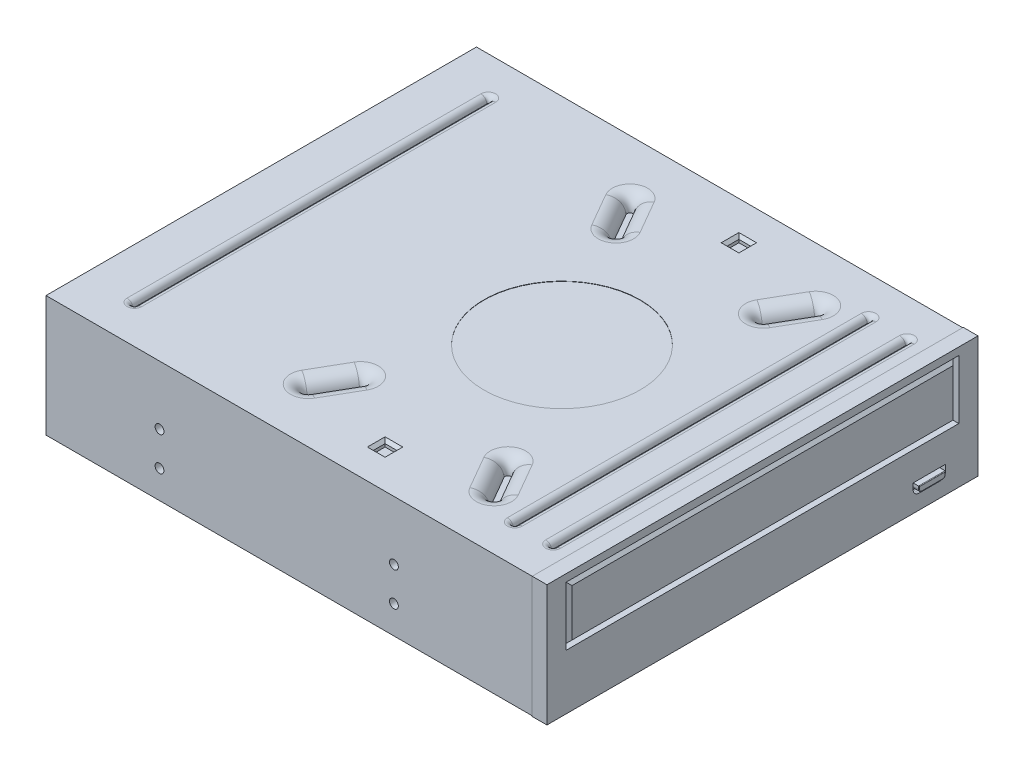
SolidWorks part; units mm, degrees
ref_plane "Front Plane" through (0, 0, 0) normal (0, 0, 1) x (1, 0, 0)
ref_plane "Top Plane" through (0, 0, 0) normal (0, 1, 0) x (1, 0, 0)
ref_plane "Right Plane" through (0, 0, 0) normal (1, 0, 0) x (0, 0, -1)
sketch "Sketch1" plane through (0, 0, 0) normal (0, 0, 1) x (1, 0, 0)
  line L1 (0, 0) -> (165, 0)
  line L2 (0, 0) -> (0, 41)
  line L3 (0, 41) -> (165, 41)
  line L4 (165, 0) -> (165, 41)
  dimension "D1" = 165
  dimension "D2" = 41
extrude "Boss-Extrude1" add sketch "Sketch1" along normal blind 146
sketch "Sketch2" plane through (165, 0, 0) normal (1, 0, 0) x (0, 0, -1)
  line L0 (-146, 41) -> (0, 41) construction
  line L1 (-146.1, 41.1) -> (0.1, 41.1)
  line L2 (-146.1, 41.1) -> (-146.1, -0.1)
  line L3 (-146.1, -0.1) -> (0.1, -0.1)
  line L4 (0.1, 41.1) -> (0.1, -0.1)
  line L5 (0, 0) -> (0, 41) construction
  line L6 (-146, 0) -> (0, 0) construction
  line L7 (-146, 0) -> (-146, 41) construction
  dimension "D1" = 0.1
  dimension "D2" = 0.1
  dimension "D3" = 0.1
  dimension "D4" = 0.1
extrude "Boss-Extrude2" add sketch "Sketch2" along normal blind 5
sketch "Sketch3" plane through (0, 41, 0) normal (0, 1, 0) x (1, 0, 0)
  line L0 (0, -146) -> (0, 0) construction
  line L1 (0, -73) -> (114.4958, -73) construction
  circle A0 centre (102, -73) radius 26.5
  dimension "D2" = 53
  dimension "D1" = 102
extrude "Cut-Extrude1" cut sketch "Sketch3" against normal blind 0.1
sketch "Sketch4" plane through (0, 41, 0) normal (0, 1, 0) x (1, 0, 0)
  line L0 (102, -73) -> (127, -29.6987) construction
  line L1 (102, -73) -> (77, -116.3013) construction
  line L2 (102, -73) -> (77, -29.6987) construction
  line L3 (102, -73) -> (127, -116.3013) construction
  line L4 (165, -73) -> (102, -73) construction
  line L5 (165, -146) -> (165, 0) construction
  line L6 (77, -29.6987) -> (70.5, -18.4404) construction
  line L7 (76.134, -30.1987) -> (69.634, -18.9404)
  line L8 (77.866, -29.1987) -> (71.366, -17.9404)
  line L9 (127, -29.6987) -> (133.5, -18.4404) construction
  line L10 (126.134, -29.1987) -> (132.634, -17.9404)
  line L11 (127.866, -30.1987) -> (134.366, -18.9404)
  line L12 (127, -116.3013) -> (133.5, -127.5596) construction
  line L13 (127.866, -115.8013) -> (134.366, -127.0596)
  line L14 (126.134, -116.8013) -> (132.634, -128.0596)
  line L15 (77, -116.3013) -> (70.5, -127.5596) construction
  line L16 (77.866, -116.8013) -> (71.366, -128.0596)
  line L17 (76.134, -115.8013) -> (69.634, -127.0596)
  arc A0 (76.134, -30.1987) -> (77.866, -29.1987) centre (77, -29.6987) ccw
  arc A1 (71.366, -17.9404) -> (69.634, -18.9404) centre (70.5, -18.4404) ccw
  arc A2 (126.134, -29.1987) -> (127.866, -30.1987) centre (127, -29.6987) ccw
  arc A3 (134.366, -18.9404) -> (132.634, -17.9404) centre (133.5, -18.4404) ccw
  arc A4 (127.866, -115.8013) -> (126.134, -116.8013) centre (127, -116.3013) ccw
  arc A5 (132.634, -128.0596) -> (134.366, -127.0596) centre (133.5, -127.5596) ccw
  arc A6 (77.866, -116.8013) -> (76.134, -115.8013) centre (77, -116.3013) ccw
  arc A7 (69.634, -127.0596) -> (71.366, -128.0596) centre (70.5, -127.5596) ccw
  point P7 (73.75, -24.0696)
  point P15 (130.25, -24.0696)
  point P21 (130.25, -121.9304)
  point P27 (73.75, -121.9304)
  dimension "D7" = 1
  dimension "D9" = 1
  dimension "D10" = 1
  dimension "D11" = 1
  dimension "D1" = 120
  dimension "D2" = 60
  dimension "D3" = 50
  dimension "D4" = 50
  dimension "D5" = 50
  dimension "D6" = 50
  dimension "D8" = 13
  dimension "D12" = 13
  dimension "D13" = 13
  dimension "D14" = 13
extrude "Cut-Extrude3" cut sketch "Sketch4" against normal blind 5
sketch "Sketch5" plane through (0, 41, 0) normal (0, 1, 0) x (1, 0, 0)
  line L0 (17, 0) -> (17, -146) construction
  line L1 (165, 0) -> (0, 0) construction
  line L2 (165, -146) -> (0, -146) construction
  line L3 (0, -146) -> (0, 0) construction
  line L4 (17, -13) -> (17, -133) construction
  line L5 (17.5, -13) -> (17.5, -133)
  line L6 (16.5, -13) -> (16.5, -133)
  arc A0 (17.5, -13) -> (16.5, -13) centre (17, -13) ccw
  arc A1 (16.5, -133) -> (17.5, -133) centre (17, -133) ccw
  point P10 (17, -73)
  dimension "D2" = 0.5
  dimension "D1" = 17
  dimension "D3" = 13
  dimension "D4" = 13
extrude "Cut-Extrude4" cut sketch "Sketch5" against normal blind 2
pattern_linear "LPattern1" count 2 spacing 129 along (1, 0, 0) of "Cut-Extrude4"
pattern_linear "LPattern2" count 2 spacing 142 along (1, 0, 0) of "Cut-Extrude4"
fillet "Fillet2" radius 2 12 edges at (159, 41, 133.5) (158.5, 41, 73) (159, 41, 12.5) (146, 41, 133.5) (145.5, 41, 73) (146, 41, 12.5) (17, 41, 133.5) (16.5, 41, 73) (17, 41, 12.5) (159.5, 41, 73) (146.5, 41, 73) (17.5, 41, 73)
fillet "Fillet3" radius 5 16 edges at (77.5, 41, 30.5648) (72.884, 41, 24.5696) (70, 41, 17.5744) (70, 41, 128.4256) (72.884, 41, 121.4304) (77.5, 41, 115.4352) (134, 41, 128.4256) (129.384, 41, 122.4304) (126.5, 41, 115.4352) (126.5, 41, 30.5648) (129.384, 41, 23.5696) (134, 41, 17.5744) (74.616, 41, 23.5696) (74.616, 41, 122.4304) (131.116, 41, 121.4304) (131.116, 41, 24.5696)
sketch "Sketch6" plane through (0, 41, 0) normal (0, 1, 0) x (1, 0, 0)
  line L0 (165, 0) -> (0, 0) construction
  line L1 (100, -11) -> (104, -11)
  line L2 (100, -11) -> (100, -15)
  line L3 (100, -15) -> (104, -15)
  line L4 (104, -11) -> (104, -15)
  line L5 (100, -131) -> (104, -131)
  line L6 (100, -131) -> (100, -135)
  line L7 (100, -135) -> (104, -135)
  line L8 (104, -131) -> (104, -135)
  line L9 (165, -146) -> (0, -146) construction
  line L10 (102, -73) -> (102, 3.7968) construction
  line L11 (102, 3.7968) -> (102, -149.076) construction
  dimension "D1" = 4
  dimension "D2" = 11
  dimension "D3" = 11
  dimension "D4" = 2
  dimension "D5" = 2
extrude "Cut-Extrude5" cut sketch "Sketch6" against normal blind 2
chamfer "Chamfer2" distance 1 angle 45 8 edges at (100, 41, 133) (102, 41, 135) (104, 41, 133) (102, 41, 131) (100, 41, 13) (102, 41, 15) (104, 41, 13) (102, 41, 11)
sketch "Sketch7" plane through (0, 0, 0) normal (-1, 0, 0) x (0, 0, 1)
  line L0 (146, 41) -> (0, 41) construction
  line L1 (1, 35) -> (145, 35)
  line L2 (1, 35) -> (1, 6)
  line L3 (1, 6) -> (145, 6)
  line L4 (145, 35) -> (145, 6)
  line L5 (146, 0) -> (0, 0) construction
  line L6 (0, 41) -> (0, 0) construction
  line L7 (146, 41) -> (146, 0) construction
  dimension "D1" = 6
  dimension "D2" = 6
  dimension "D3" = 1
  dimension "D4" = 1
extrude "Cut-Extrude6" cut sketch "Sketch7" against normal blind 1
sketch "Sketch8" plane through (1, 0, 0) normal (-1, 0, 0) x (0, 0, 1)
  line L0 (1, 6) -> (145, 6) construction
  line L1 (5, 16.1) -> (18, 16.1)
  line L2 (5, 16.1) -> (5, 6.1)
  line L3 (5, 6.1) -> (18, 6.1)
  line L4 (18, 16.1) -> (18, 6.1)
  line L5 (1, 35) -> (1, 6) construction
  line L6 (24, 11) -> (25, 11)
  line L7 (20, 11) -> (21, 11)
  line L8 (20, 11) -> (20, 8)
  line L9 (20, 8) -> (22, 8)
  line L10 (25, 11) -> (25, 8)
  line L11 (23, 8) -> (25, 8)
  line L12 (21, 11) -> (21, 12)
  line L13 (21, 12) -> (24, 12)
  line L14 (24, 11) -> (24, 12)
  line L15 (27, 11) -> (29.5, 11)
  line L16 (27, 11) -> (27, 8)
  line L17 (27, 8) -> (29.5, 8)
  line L18 (37, 11) -> (37, 8)
  line L19 (30.5, 8) -> (33.5, 8)
  line L20 (29.5, 11) -> (29.5, 12)
  line L21 (29.5, 12) -> (34.5, 12)
  line L22 (34.5, 11) -> (34.5, 12)
  line L23 (34.5, 11) -> (37, 11)
  line L24 (22, 8) -> (22, 6)
  line L25 (22, 6) -> (23, 6)
  line L26 (23, 8) -> (23, 6)
  line L27 (34.5, 8) -> (37, 8)
  line L28 (29.5, 8) -> (29.5, 6)
  line L29 (29.5, 6) -> (30.5, 6)
  line L30 (30.5, 8) -> (30.5, 6)
  line L31 (111.5, 12.5858) -> (112.9142, 14)
  line L32 (34.5, 8) -> (34.5, 6)
  line L33 (34.5, 6) -> (33.5, 6)
  line L34 (33.5, 8) -> (33.5, 6)
  line L35 (39, 16.1) -> (51, 16.1)
  line L36 (39, 16.1) -> (39, 6.1)
  line L37 (39, 6.1) -> (51, 6.1)
  line L38 (51, 16.1) -> (51, 6.1)
  line L39 (53, 14) -> (109, 14)
  line L40 (53, 14) -> (53, 7)
  line L41 (53, 7) -> (109, 7)
  line L42 (109, 14) -> (109, 7)
  line L43 (112.9142, 14) -> (131.0858, 14)
  line L44 (111.5, 12.5858) -> (111.5, 7)
  line L45 (111.5, 7) -> (132.5, 7)
  line L46 (132.5, 12.5858) -> (132.5, 7)
  line L47 (132.5, 12.5858) -> (131.0858, 14)
  dimension "D1" = 0.1
  dimension "D2" = 13
  dimension "D3" = 10
  dimension "D4" = 4
  dimension "D5" = 2
  dimension "D6" = 2
  dimension "D7" = 3
  dimension "D8" = 3
  dimension "D9" = 5
  dimension "D10" = 1
  dimension "D11" = 1
  dimension "D12" = 2
  dimension "D13" = 2
  dimension "D14" = 2
  dimension "D15" = 2
  dimension "D16" = 2
  dimension "D17" = 2
  dimension "D18" = 1
  dimension "D19" = 1
  dimension "D20" = 3
  dimension "D21" = 5
  dimension "D22" = 10
  dimension "D23" = 2.5
  dimension "D24" = 1
  dimension "D25" = 1
  dimension "D26" = 2.5
  dimension "D27" = 2.5
  dimension "D28" = 10
  dimension "D29" = 0.1
  dimension "D30" = 2
  dimension "D31" = 2
  dimension "D32" = 12
  dimension "D33" = 1
  dimension "D34" = 7
  dimension "D35" = 56
  dimension "D36" = 1
  dimension "D37" = 2.5
  dimension "D38" = 21
  dimension "D39" = 2
  dimension "D40" = 2
  dimension "D41" = 135
  dimension "D42" = 135
  dimension "D43" = 7
extrude "Cut-Extrude7" cut sketch "Sketch8" against normal blind 10
sketch "Sketch9" plane through (11, 0, 0) normal (-1, 0, 0) x (0, 0, 1)
  line L1 (22, 6) -> (23, 6) construction
  line L2 (20, 11) -> (20, 8) construction
  line L3 (23, 8) -> (25, 8) construction
  line L4 (27, 8) -> (29.5, 8) construction
  line L5 (51, 16.1) -> (39, 16.1) construction
  line L6 (51, 6.1) -> (51, 16.1) construction
  line L7 (27, 11) -> (27, 8) construction
  circle A0 centre (21.5, 9.5) radius 0.25
  circle A1 centre (23.5, 9.5) radius 0.25
  circle A2 centre (29, 9.5) radius 0.25
  circle A3 centre (31, 9.5) radius 0.25
  circle A4 centre (33, 9.5) radius 0.25
  circle A5 centre (35, 9.5) radius 0.25
  circle A6 centre (43, 12.1) radius 0.25
  circle A7 centre (45, 12.1) radius 0.25
  circle A8 centre (47, 12.1) radius 0.25
  circle A9 centre (47, 10.1) radius 0.25
  circle A10 centre (45, 10.1) radius 0.25
  circle A11 centre (43, 10.1) radius 0.25
  circle A12 centre (63.1733, 11.5642) radius 0.25
  circle A13 centre (65.1733, 11.5642) radius 0.25
  circle A14 centre (67.1733, 11.5642) radius 0.25
  circle A15 centre (67.1733, 9.5642) radius 0.25
  circle A16 centre (65.1733, 9.5642) radius 0.25
  circle A17 centre (63.1733, 9.5642) radius 0.25
  circle A18 centre (69.1733, 11.5642) radius 0.25
  circle A19 centre (71.1733, 11.5642) radius 0.25
  circle A20 centre (73.1733, 11.5642) radius 0.25
  circle A21 centre (73.1733, 9.5642) radius 0.25
  circle A22 centre (71.1733, 9.5642) radius 0.25
  circle A23 centre (69.1733, 9.5642) radius 0.25
  circle A24 centre (75.1733, 11.5642) radius 0.25
  circle A25 centre (77.1733, 11.5642) radius 0.25
  circle A26 centre (79.1733, 11.5642) radius 0.25
  circle A27 centre (79.1733, 9.5642) radius 0.25
  circle A28 centre (77.1733, 9.5642) radius 0.25
  circle A29 centre (75.1733, 9.5642) radius 0.25
  circle A30 centre (81.1733, 11.5642) radius 0.25
  circle A31 centre (83.1733, 11.5642) radius 0.25
  circle A32 centre (85.1733, 11.5642) radius 0.25
  circle A33 centre (85.1733, 9.5642) radius 0.25
  circle A34 centre (83.1733, 9.5642) radius 0.25
  circle A35 centre (81.1733, 9.5642) radius 0.25
  circle A36 centre (87.1733, 11.5642) radius 0.25
  circle A37 centre (89.1733, 11.5642) radius 0.25
  circle A38 centre (91.1733, 11.5642) radius 0.25
  circle A39 centre (91.1733, 9.5642) radius 0.25
  circle A40 centre (89.1733, 9.5642) radius 0.25
  circle A41 centre (87.1733, 9.5642) radius 0.25
  circle A42 centre (93.1733, 11.5642) radius 0.25
  circle A43 centre (95.1733, 11.5642) radius 0.25
  circle A44 centre (97.1733, 11.5642) radius 0.25
  circle A45 centre (97.1733, 9.5642) radius 0.25
  circle A46 centre (95.1733, 9.5642) radius 0.25
  circle A47 centre (93.1733, 9.5642) radius 0.25
  circle A48 centre (99.1733, 11.5642) radius 0.25
  circle A49 centre (101.1733, 11.5642) radius 0.25
  circle A50 centre (101.1733, 9.5642) radius 0.25
  circle A51 centre (99.1733, 9.5642) radius 0.25
  circle A52 centre (115.4086, 10.1) radius 1
  circle A53 centre (119.4086, 10.1) radius 1
  circle A54 centre (123.4086, 10.1) radius 1
  circle A55 centre (127.4086, 10.1) radius 1
  point P7 (22.5, 6)
  point P8 (20, 9.5)
  point P35 (45, 16.1)
  dimension "D1" = 0.5
  dimension "D2" = 1.5
  dimension "D12" = 2
  dimension "D58" = 2
  dimension "D3" = 1
  dimension "D4" = 2
  dimension "D5" = 0
  dimension "D6" = 1.5
  dimension "D7" = 2
  dimension "D8" = 2
  dimension "D9" = 2
  dimension "D10" = 2
  dimension "D11" = 2
  dimension "D13" = 2
  dimension "D14" = 2
  dimension "D15" = 4
  dimension "D16" = 6
  dimension "D17" = 2
  dimension "D18" = 2
  dimension "D19" = 2
  dimension "D20" = 2
  dimension "D21" = 2
  dimension "D22" = 2
  dimension "D23" = 2
  dimension "D24" = 2
  dimension "D25" = 2
  dimension "D26" = 2
  dimension "D27" = 2
  dimension "D28" = 2
  dimension "D29" = 2
  dimension "D30" = 2
  dimension "D31" = 2
  dimension "D32" = 2
  dimension "D33" = 2
  dimension "D34" = 2
  dimension "D35" = 2
  dimension "D36" = 2
  dimension "D37" = 2
  dimension "D38" = 2
  dimension "D39" = 2
  dimension "D40" = 2
  dimension "D41" = 2
  dimension "D42" = 2
  dimension "D43" = 2
  dimension "D44" = 2
  dimension "D45" = 2
  dimension "D46" = 2
  dimension "D47" = 2
  dimension "D48" = 2
  dimension "D49" = 2
  dimension "D50" = 2
  dimension "D51" = 2
  dimension "D52" = 2
  dimension "D53" = 2
  dimension "D54" = 2
  dimension "D55" = 2
  dimension "D56" = 2
  dimension "D57" = 2
  dimension "D59" = 4
  dimension "D60" = 4
  dimension "D61" = 4
extrude "Boss-Extrude3" add sketch "Sketch9" along normal blind 8
fillet "Fillet4" radius 0.25 52 edges at (3, 11.5642, 101.4233) (3, 9.5642, 101.4233) (3, 9.5642, 99.4233) (3, 11.5642, 99.4233) (3, 11.5642, 97.4233) (3, 9.5642, 97.4233) (3, 9.5642, 95.4233) (3, 11.5642, 95.4233) (3, 11.5642, 93.4233) (3, 9.5642, 93.4233) (3, 9.5642, 91.4233) (3, 11.5642, 91.4233) (3, 11.5642, 89.4233) (3, 11.5642, 87.4233) (3, 9.5642, 87.4233) (3, 9.5642, 85.4233) (3, 11.5642, 85.4233) (3, 9.5642, 83.4233) (3, 11.5642, 83.4233) (3, 9.5642, 81.4233) (3, 11.5642, 81.4233) (3, 11.5642, 79.4233) (3, 9.5642, 79.4233) (3, 9.5642, 77.4233) (3, 11.5642, 77.4233) (3, 11.5642, 75.4233) (3, 9.5642, 75.4233) (3, 9.5642, 73.4233) (3, 11.5642, 73.4233) (3, 9.5642, 71.4233) (3, 11.5642, 71.4233) (3, 11.5642, 69.4233) (3, 9.5642, 69.4233) (3, 9.5642, 67.4233) (3, 11.5642, 67.4233) (3, 11.5642, 65.4233) (3, 9.5642, 65.4233) (3, 9.5642, 63.4233) (3, 11.5642, 63.4233) (3, 10.1, 43.25) (3, 10.1, 45.25) (3, 10.1, 47.25) (3, 12.1, 47.25) (3, 12.1, 45.25) (3, 12.1, 43.25) (3, 9.5, 35.25) (3, 9.5, 33.25) (3, 9.5, 31.25) (3, 9.5, 29.25) (3, 9.5, 23.75) (3, 9.5, 21.75) (3, 9.5642, 89.4233)
fillet "Fillet5" radius 1 4 edges at (3, 10.1, 128.4086) (3, 10.1, 124.4086) (3, 10.1, 120.4086) (3, 10.1, 116.4086)
sketch "Sketch10" plane through (0, 0, 0) normal (0, 0, -1) x (-1, 0, 0)
  line L0 (0, 41) -> (0, 0) construction
  line L1 (0, 0) -> (-165, 0) construction
  circle A0 centre (-38.5, 21) radius 1.5
  circle A1 centre (-38.5, 9.5) radius 1.5
  circle A2 centre (-118, 21) radius 1.5
  circle A3 centre (-118, 9.5) radius 1.5
  dimension "D4" = 3
  dimension "D1" = 38.5
  dimension "D2" = 9.5
  dimension "D3" = 11.5
  dimension "D5" = 79.5
extrude "Cut-Extrude8" cut sketch "Sketch10" against normal blind 5
ref_plane "Plane1" through (0, 0, 73) normal (0, 0, -1) x (-1, 0, 0)
mirror "Mirror1" about plane through (0, 0, 73) normal (0, 0, -1) of "Cut-Extrude8"
sketch "Sketch11" plane through (0, 0, 0) normal (0, -1, 0) x (1, 0, 0)
  line L0 (0, 146) -> (165, 146) construction
  line L1 (0, 0) -> (165, 0) construction
  line L4 (0, 146) -> (0, 0) construction
  circle A0 centre (118, 143) radius 1.5
  circle A1 centre (118, 3) radius 1.5
  circle A2 centre (38.5, 3) radius 1.5
  circle A3 centre (38.5, 143) radius 1.5
  dimension "D1" = 3
  dimension "D2" = 3
  dimension "D3" = 3
  dimension "D4" = 38.5
  dimension "D5" = 79.5
extrude "Cut-Extrude9" cut sketch "Sketch11" against normal blind 5
sketch "Sketch12" plane through (170, 0, 0) normal (1, 0, 0) x (0, 0, -1)
  line L0 (0.1, 41.1) -> (-146.1, 41.1) construction
  line L1 (-139.6, 38.6) -> (-6.4, 38.6)
  line L2 (-139.6, 38.6) -> (-139.6, 18.6)
  line L3 (-139.6, 18.6) -> (-6.4, 18.6)
  line L4 (-6.4, 38.6) -> (-6.4, 18.6)
  line L5 (-138.6, 37.6) -> (-7.4, 37.6)
  line L6 (-138.6, 37.6) -> (-138.6, 19.6)
  line L7 (-138.6, 19.6) -> (-7.4, 19.6)
  line L8 (-7.4, 37.6) -> (-7.4, 19.6)
  line L9 (0.1, -0.1) -> (0.1, 41.1) construction
  line L10 (-146.1, 41.1) -> (-146.1, -0.1) construction
  dimension "D1" = 1
  dimension "D2" = 1
  dimension "D3" = 1
  dimension "D4" = 1
  dimension "D5" = 2.5
  dimension "D6" = 6.5
  dimension "D7" = 6.5
  dimension "D8" = 20
extrude "Cut-Extrude10" cut sketch "Sketch12" against normal blind 2
chamfer "Chamfer3" distance 1 angle 45 4 edges at (170, 28.6, 7.4) (170, 19.6, 73) (170, 28.6, 138.6) (170, 37.6, 73)
sketch "Sketch13" plane through (170, 0, 0) normal (1, 0, 0) x (0, 0, -1)
  line L0 (-146.1, -0.1) -> (0.1, -0.1) construction
  line L1 (-21.9, 8.9) -> (-10.9, 8.9)
  line L2 (-21.9, 8.9) -> (-21.9, 6.9)
  line L3 (-19.9, 4.9) -> (-12.9, 4.9)
  line L4 (-10.9, 8.9) -> (-10.9, 6.9)
  line L5 (0.1, -0.1) -> (0.1, 41.1) construction
  line L6 (-20.9, 7.9) -> (-11.9, 7.9)
  line L7 (-11.9, 7.9) -> (-11.9, 6.9)
  line L8 (-19.9, 5.9) -> (-12.9, 5.9)
  line L9 (-20.9, 7.9) -> (-20.9, 6.9)
  arc A0 (-12.9, 4.9) -> (-10.9, 6.9) centre (-12.9, 6.9) ccw
  arc A1 (-21.9, 6.9) -> (-19.9, 4.9) centre (-19.9, 6.9) ccw
  arc A2 (-12.9, 5.9) -> (-11.9, 6.9) centre (-12.9, 6.9) ccw
  arc A3 (-20.9, 6.9) -> (-19.9, 5.9) centre (-19.9, 6.9) ccw
  dimension "D1" = 2
  dimension "D2" = 11
  dimension "D3" = 2
  dimension "D4" = 5
  dimension "D5" = 11
  dimension "D6" = 1
extrude "Cut-Extrude11" cut sketch "Sketch13" against normal blind 2
sketch "Sketch14" plane through (170, 0, 0) normal (1, 0, 0) x (0, 0, -1)
  line L0 (-20.9, 7.9) -> (-11.9, 7.9)
  line L1 (-11.9, 7.9) -> (-11.9, 6.9)
  line L2 (-12.8374, 5.9) -> (-19.9, 5.9)
  line L3 (-20.9, 7.9) -> (-20.9, 6.9) construction
  line L4 (-20.9, 6.9) -> (-20.9, 7.9)
  arc A0 (-11.9, 6.9) -> (-12.8374, 5.9) centre (-12.9021, 6.9) cw
  arc A1 (-19.9, 5.9) -> (-20.9, 6.9) centre (-19.9, 6.9) cw
  arc A2 (-20.9, 6.9) -> (-19.9, 5.9) centre (-19.9, 6.9) ccw construction
  dimension "D1" = 1
  dimension "D2" = 1.0021
extrude "Boss-Extrude4" add sketch "Sketch14" along normal blind 1
fillet "Fillet6" radius 0.2 6 edges at (171, 7.9, 16.4) (171, 7.4, 11.9) (171, 6.2147, 12.171) (171, 5.9, 16.3687) (171, 6.1929, 20.6071) (171, 7.4, 20.9)
